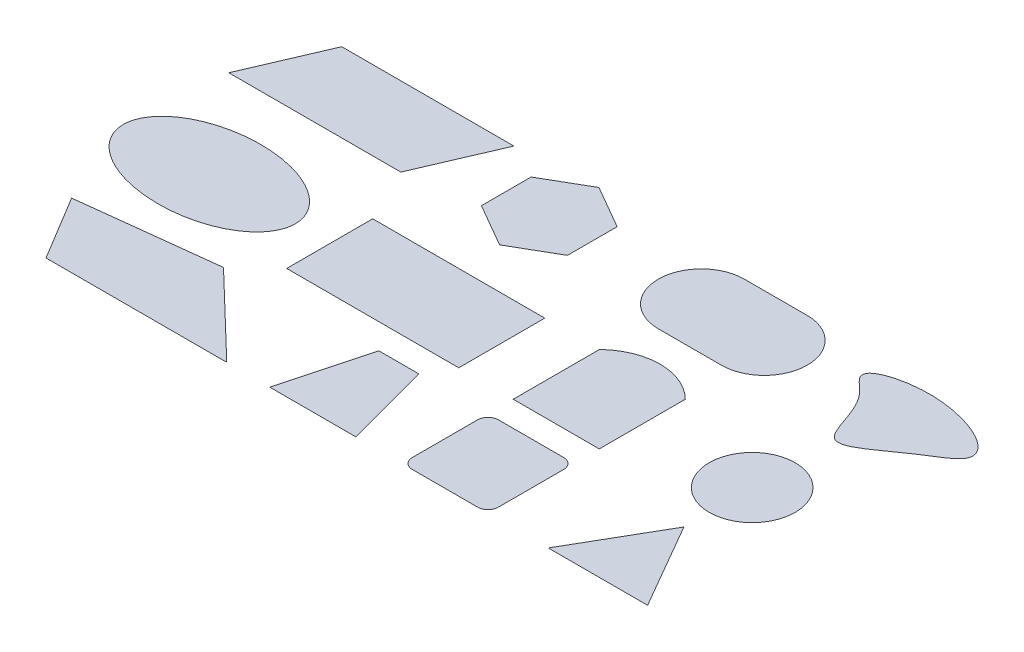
SolidWorks part; units mm, degrees
ref_plane "Front Plane" through (0, 0, 0) normal (0, 0, 1) x (1, 0, 0)
ref_plane "Top Plane" through (0, 0, 0) normal (0, 1, 0) x (1, 0, 0)
ref_plane "Right Plane" through (0, 0, 0) normal (1, 0, 0) x (0, 0, -1)
sketch "Sketch1" plane through (0, 0, 0) normal (0, 0, 1) x (1, 0, 0)
  line L0 (0, 0) -> (50.6357, 0) construction
  line L1 (0, 25) -> (-25, 25) construction
  arc A0 (0, 0) -> (-25, 25) centre (0, 25) cw
  dimension "D1" = 25
surface "Surface-Extrude1" sketch "Sketch1" parameters "D1"=50
sketch "Sketch2" plane through (0, 0, 0) normal (0, 0, 1) x (1, 0, 0)
  line L0 (0, 0) -> (100, 0)
  dimension "D1" = 100
surface "Surface-Extrude2" sketch "Sketch2" parameters "D1"=50
sketch "Sketch3" plane through (0, 0, 0) normal (0, 0, 1) x (1, 0, 0)
  line L0 (100, 0) -> (150, 0)
  dimension "D1" = 50
surface "Surface-Extrude3" sketch "Sketch3" parameters "D1"=50
sketch "Sketch6" plane through (0, 0, 0) normal (0, 1, 0) x (1, 0, 0)
  line L0 (140.1114, 123.0805) -> (198.1506, 123.0805) construction
  line L1 (0, 168.8546) -> (-39.6415, 145.9676)
  line L2 (-39.6415, 145.9676) -> (-39.6415, 100.1935)
  line L3 (-39.6415, 100.1935) -> (0, 77.3065)
  line L4 (0, 77.3065) -> (39.6415, 100.1935)
  line L5 (39.6415, 100.1935) -> (39.6415, 145.9676)
  line L6 (39.6415, 145.9676) -> (0, 168.8546)
  line L7 (140.1114, 162.722) -> (198.1506, 162.722)
  line L8 (140.1114, 83.4391) -> (198.1506, 83.4391)
  line L9 (310.0611, -62.8834) -> (355.8352, -142.1664)
  line L10 (-79.283, 39.6415) -> (79.283, 39.6415)
  line L11 (-79.283, 39.6415) -> (-79.283, -39.6415)
  line L12 (-79.283, -39.6415) -> (79.283, -39.6415)
  line L13 (79.283, 39.6415) -> (79.283, -39.6415)
  line L14 (-79.283, 39.6415) -> (79.283, -39.6415) construction
  line L15 (-79.283, -39.6415) -> (79.283, 39.6415) construction
  line L16 (355.8352, -142.1664) -> (264.2871, -142.1664)
  line L17 (264.2871, -142.1664) -> (310.0611, -62.8834)
  line L18 (28.9378, -62.8834) -> (7.694, -142.1664)
  line L19 (7.694, -142.1664) -> (86.977, -142.1664)
  line L20 (86.977, -142.1664) -> (65.7332, -62.8834)
  line L21 (65.7332, -62.8834) -> (28.9378, -62.8834)
  line L22 (129.4895, 39.6415) -> (129.4895, -39.6415)
  line L23 (129.4895, -39.6415) -> (208.7725, -39.6415)
  line L24 (208.7725, -39.6415) -> (208.7725, 39.6415)
  line L25 (138.9399, -142.1664) -> (199.3221, -142.1664)
  line L26 (208.7725, -132.716) -> (208.7725, -72.3338)
  line L27 (199.3221, -62.8834) -> (138.9399, -62.8834)
  line L28 (129.4895, -72.3338) -> (129.4895, -132.716)
  line L29 (198.1506, 162.722) -> (198.1506, 83.4391) construction
  line L30 (0, 0) -> (-79.283, 0) construction
  line L31 (-39.6415, 123.0805) -> (39.6415, 123.0805) construction
  line L32 (310.0611, 39.6415) -> (310.0611, -39.6415) construction
  line L33 (47.3355, -62.8834) -> (47.3355, -142.1664) construction
  line L34 (129.4895, -102.5249) -> (208.7725, -102.5249) construction
  line L35 (169.131, -142.1664) -> (169.131, -62.8834) construction
  line L36 (18.3159, -102.5249) -> (76.3551, -102.5249) construction
  line L37 (310.0611, -62.8834) -> (310.0611, -142.1664) construction
  line L38 (169.131, 0) -> (169.131, -39.6415) construction
  line L39 (169.131, 123.0805) -> (169.131, 83.4391) construction
  line L40 (0, 123.0805) -> (0, 77.3065) construction
  line L41 (0, 0) -> (0, -39.6415) construction
  line L42 (310.0611, 0) -> (270.4196, 0) construction
  line L43 (310.0611, 156.1826) -> (310.0611, 76.4065) construction
  line L44 (285.6337, 123.0805) -> (385.7854, 123.0805) construction
  line L45 (-230.8771, 162.722) -> (-72.3112, 162.722)
  line L46 (-72.3112, 162.722) -> (-103.5885, 89.8693)
  line L47 (-103.5885, 89.8693) -> (-262.1544, 89.8693)
  line L48 (-262.1544, 89.8693) -> (-230.8771, 162.722)
  line L54 (-269.5005, 0) -> (-190.2175, 0) construction
  line L55 (-190.2175, 0) -> (-110.9345, 0) construction
  line L63 (-31.9917, -142.1664) -> (-198.5552, -142.1664)
  line L64 (-198.5552, -142.1664) -> (-234.5505, -82.5791)
  line L65 (-234.5505, -82.5791) -> (-109.2147, -67.9419)
  line L66 (-109.2147, -67.9419) -> (-31.9917, -142.1664)
  circle A0 centre (0, 123.0805) radius 39.6415 construction
  arc A1 (140.1114, 162.722) -> (140.1114, 83.4391) centre (140.1114, 123.0805) ccw
  arc A2 (198.1506, 83.4391) -> (198.1506, 162.722) centre (198.1506, 123.0805) ccw
  circle A3 centre (310.0611, 0) radius 39.6415
  arc A4 (129.4895, 39.6415) -> (208.7725, 39.6415) centre (169.131, 0) cw
  arc A5 (138.9399, -142.1664) -> (129.4895, -132.716) centre (138.9399, -132.716) cw
  arc A6 (199.3221, -142.1664) -> (208.7725, -132.716) centre (199.3221, -132.716) ccw
  arc A7 (208.7725, -72.3338) -> (199.3221, -62.8834) centre (199.3221, -72.3338) ccw
  arc A8 (138.9399, -62.8834) -> (129.4895, -72.3338) centre (138.9399, -72.3338) ccw
  ellipse E0 centre (-190.2175, 0) end of major axis (-110.9345, 0) minor radius 47.3849
  spline S0 degree 3 poles (411.8993, 130.4995) (329.3777, 168.5044) (257.5399, 144.4104) (298.5673, 117.7045) (301.3583, 55.4685) (350.8797, 99.761) (411.8993, 130.4995) (329.3777, 168.5044) (257.5399, 144.4104) knots -0.595048 -0.415982 -0.286012 0 0.147378 0.222637 0.404952 0.584018 0.713988 1 1.147378 1.222637 1.404952 only from (310.0611, 156.1826) to (310.0611, 156.1826)
  point P10 (169.131, 123.0805)
  point P15 (0, 0)
  dimension "D1" = 79.283
  dimension "D2" = 75
  dimension "D3" = 60
  dimension "D4" = 185.964
surface "Surface-Plane1" sketch "Sketch6"
